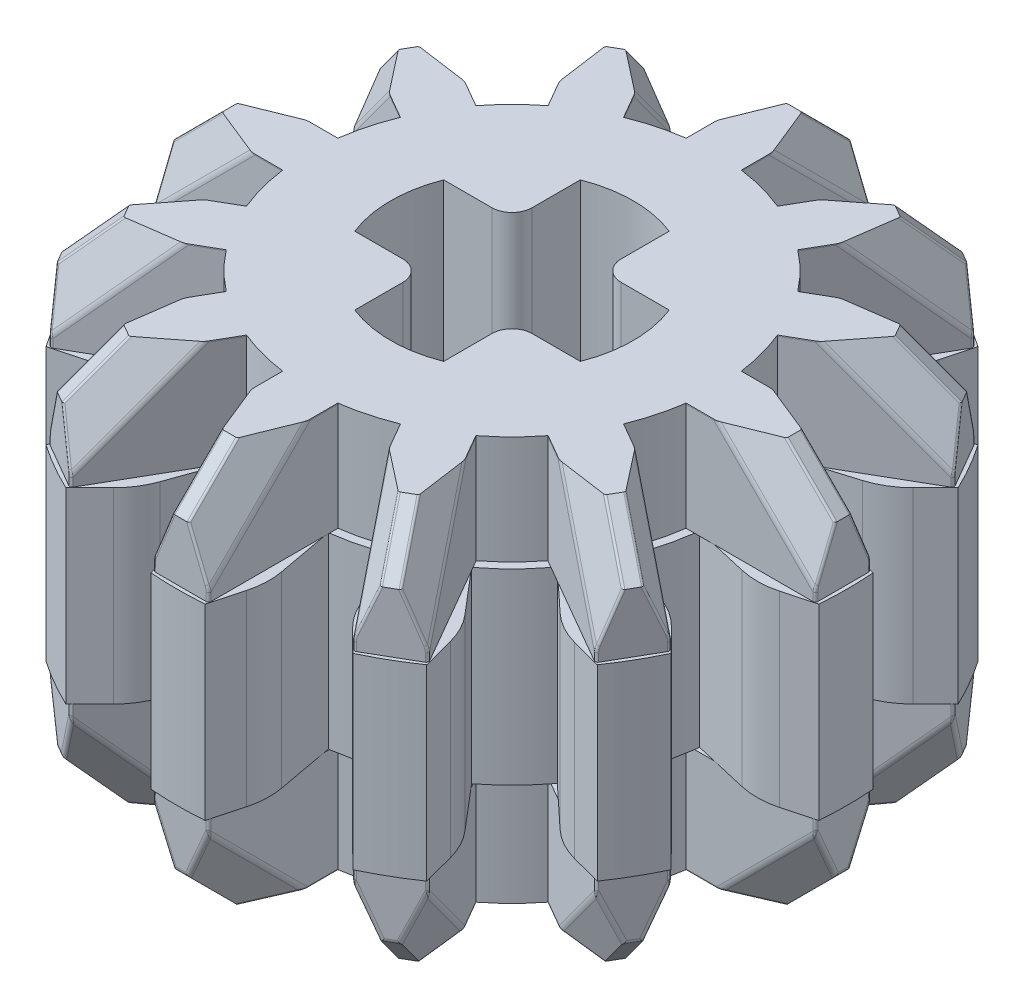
SolidWorks part; units mm, degrees
ref_plane "Front Plane" through (0, 0, 0) normal (0, 0, 1) x (1, 0, 0)
ref_plane "Top Plane" through (0, 0, 0) normal (0, 1, 0) x (1, 0, 0)
ref_plane "Right Plane" through (0, 0, 0) normal (1, 0, 0) x (0, 0, -1)
imported_body "Imported1"
sketch "Sketch1" plane through (0, 4.0325, 0) normal (0, 1, 0) x (1, 0, 0)
  circle A0 centre (0, 0) radius 2.39
extrude "Boss-Extrude1" add sketch "Sketch1" against normal up to surface (8.065 mm away)
sketch "Sketch2" plane through (0, 4.0325, 0) normal (0, 1, 0) x (1, 0, 0)
  circle A0 centre (0, 0) radius 8.3997
extrude "Cut-Extrude1" cut sketch "Sketch2" against normal blind 0.0325
mirror "Mirror1" about plane through (0, 0, 0) normal (0, 1, 0) of "Cut-Extrude1"
sketch "Sketch3" plane through (0, 4, 0) normal (0, 1, 0) x (1, 0, 0)
  line L0 (-0.88, 2.2328) -> (-0.88, 1.28)
  line L1 (0.88, 2.2328) -> (0.88, 1.28)
  line L2 (-2.2328, 0.88) -> (-1.28, 0.88)
  line L3 (2.2328, -0.88) -> (1.28, -0.88)
  line L4 (1.28, 0.88) -> (2.2328, 0.88)
  line L5 (-0.88, -1.28) -> (-0.88, -2.2328)
  line L6 (0.88, -1.28) -> (0.88, -2.2328)
  line L7 (-1.28, -0.88) -> (-2.2328, -0.88)
  arc A0 (0.88, 2.2328) -> (-0.88, 2.2328) centre (0, 0) ccw
  arc A1 (2.2328, -0.88) -> (2.2328, 0.88) centre (0, 0) ccw
  arc A2 (-0.88, -2.2328) -> (0.88, -2.2328) centre (0, 0) ccw
  arc A3 (-2.2328, 0.88) -> (-2.2328, -0.88) centre (0, 0) ccw
  arc A4 (-0.88, -1.28) -> (-1.28, -0.88) centre (-1.28, -1.28) ccw
  arc A5 (0.88, -1.28) -> (1.28, -0.88) centre (1.28, -1.28) cw
  arc A6 (1.28, 0.88) -> (0.88, 1.28) centre (1.28, 1.28) cw
  arc A7 (-1.28, 0.88) -> (-0.88, 1.28) centre (-1.28, 1.28) ccw
  point P16 (-0.88, -0.88)
  dimension "D1" = 0.88
  dimension "D5" = 0.4
  dimension "D2" = 1.76
  dimension "D3" = 0.88
  dimension "D4" = 1.76
extrude "Cut-Extrude2" cut sketch "Sketch3" against normal through all
